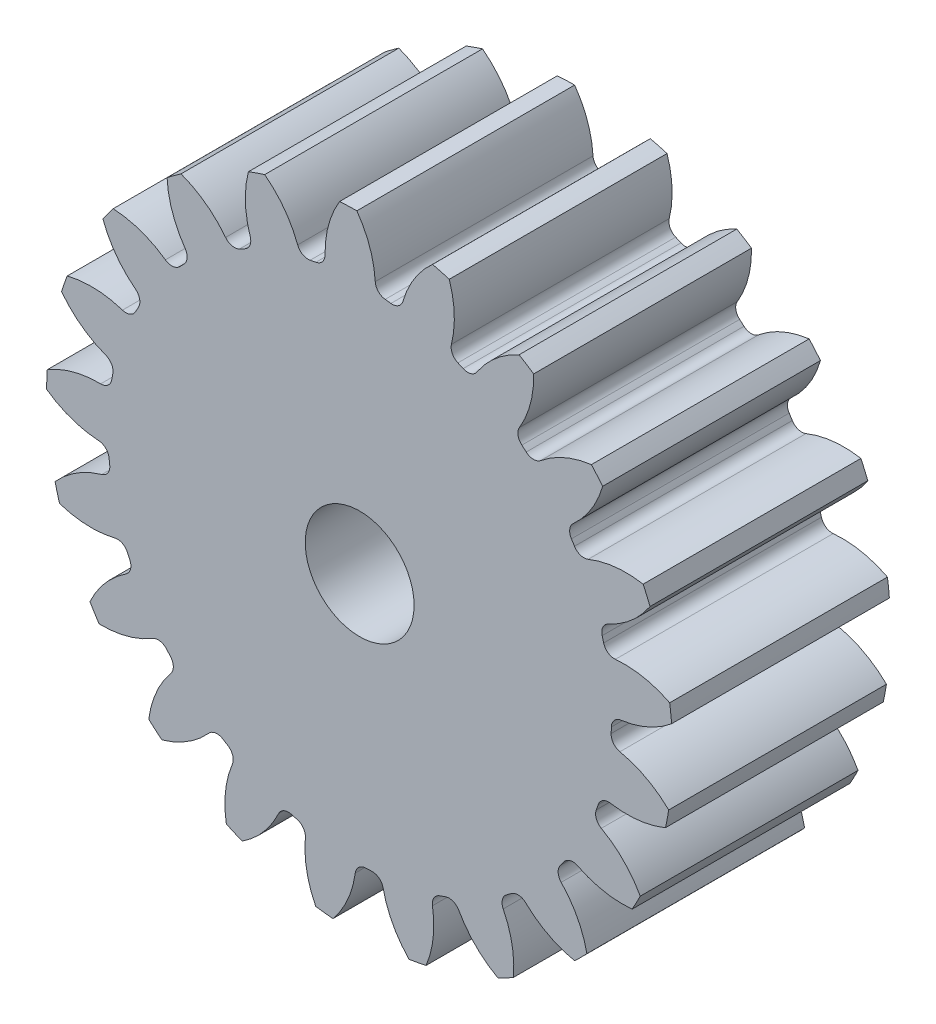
SolidWorks part; units mm, degrees
ref_plane "Front" through (0, 0, 0) normal (0, 0, 1) x (1, 0, 0)
ref_plane "Top" through (0, 0, 0) normal (0, 1, 0) x (1, 0, 0)
ref_plane "Right" through (0, 0, 0) normal (1, 0, 0) x (0, 0, -1)
sketch "Sketch3" plane through (0, 0, 0) normal (0, 0, 1) x (1, 0, 0)
  circle A0 centre (0, 0) radius 146.05
  dimension "od" = 292.1
extrude "gearBody" add sketch "Sketch3" along normal blind 101.6
sketch "Sketch2" plane through (0, 0, 0) normal (0, 0, 1) x (1, 0, 0)
  line L0 (0, 0) -> (115.7695, 47.9533) construction
  line L1 (144.6562, -23.7663) -> (0, 0) construction
  line L2 (0, 0) -> (36.3143, 0) construction
  line L3 (133.2619, 4.8458) -> (132.5013, -15.0213) construction
  line L5 (132.8816, -5.0878) -> (0, 0) construction
  line L7 (0, 0) -> (125.308, 0) construction
  arc A0 (125.2847, 2.4154) -> (124.7333, -11.9881) centre (0, 0) ccw construction
  arc A1 (145.5392, 12.2041) -> (144.18, -23.2969) centre (0, 0) ccw construction
  arc A2 (133.2619, 4.8458) -> (132.5013, -15.0213) centre (0, 0) ccw construction
  arc A3 (117.3296, -5.8433) -> (117.4329, -3.1453) centre (0, 0) ccw
  arc A4 (144.6562, -23.7663) -> (121.4193, -11.1567) centre (111.7639, -56.6651) ccw
  arc A5 (144.6562, -23.7663) -> (146.05, 12.6357) centre (0, 0) ccw
  arc A6 (146.05, 12.6357) -> (121.9169, 1.8399) centre (115.7695, 47.9533) cw
  arc A7 (117.4329, -3.1453) -> (121.9169, 1.8399) centre (122.5999, -3.2837) cw
  arc A8 (121.4193, -11.1567) -> (117.3296, -5.8433) centre (122.4921, -6.1004) cw
  point P6 (146.05, 12.6357)
  point P22 (144.6562, -23.7663)
  dimension "baseDia" = 250.616
  dimension "od" = 292.1
  dimension "pd" = 266.7
  dimension "rd" = 234.95
  dimension "rFillet" = 5.1689
  dimension "pointX" = 146.05
  dimension "pointY" = 12.6357
  dimension "CTT" = 19.8672
  dimension "flankCenterAngle" = 22.5
extrude "toothCut" cut sketch "Sketch2" along normal through all
pattern_circular "CirPattern1" count 21 over 360 about axis through (0, 0, 0) along (0, 0, 1) of "toothCut"
sketch "hub1Dia" plane through (0, 0, 0) normal (0, 0, -1) x (-1, 0, 0)
  circle A0 centre (0, 0) radius 12.7
  dimension "hub1Dia" = 25.4
sketch "hub2Dia" plane through (0, 0, 101.6) normal (0, 0, 1) x (1, 0, 0)
  circle A0 centre (0, 0) radius 12.7
  dimension "hub2dia" = 25.4
sketch "boreDia" plane through (0, 0, 0) normal (0, 0, 1) x (1, 0, 0)
  circle A0 centre (0, 0) radius 25.4
  dimension "boreDia" = 50.8
extrude "bore" cut sketch "boreDia" against normal mid plane 25400
